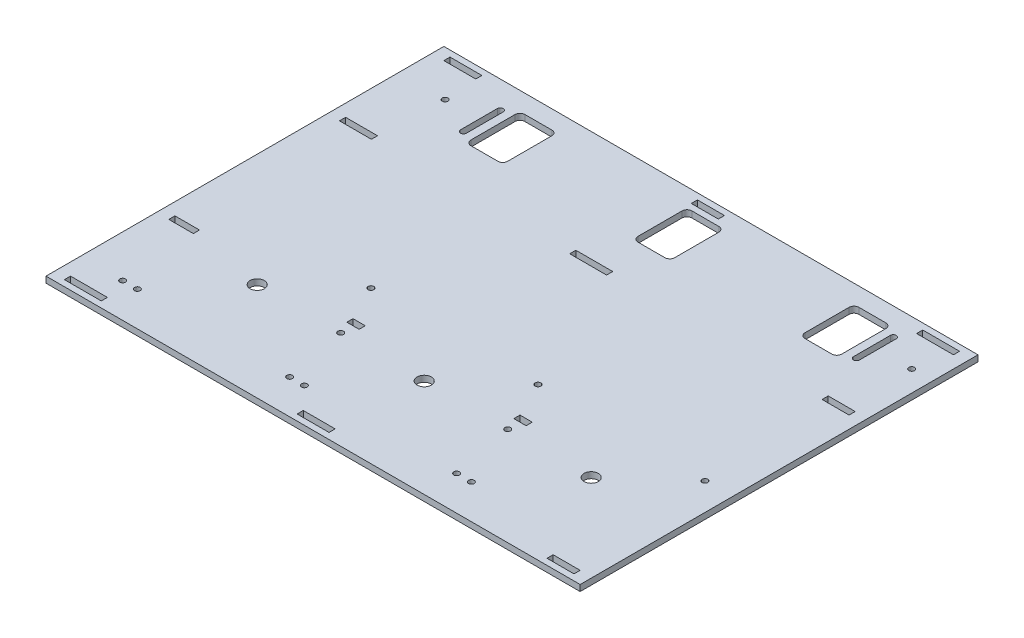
SolidWorks part; units mm, degrees
ref_plane "Front Plane" through (0, 0, 0) normal (0, 0, 1) x (1, 0, 0)
ref_plane "Top Plane" through (0, 0, 0) normal (0, 1, 0) x (1, 0, 0)
ref_plane "Right Plane" through (0, 0, 0) normal (1, 0, 0) x (0, 0, -1)
sketch "Sketch1" plane through (0, 0, 0) normal (0, 1, 0) x (1, 0, 0)
  line L0 (269.875, 145.415) -> (255.905, 145.415)
  line L1 (276.225, 205.74) -> (0, 205.74)
  line L2 (276.225, 205.74) -> (276.225, 0)
  line L3 (276.225, 0) -> (0, 0)
  line L4 (0, 205.74) -> (0, 0)
  line L5 (269.875, 199.39) -> (250.825, 199.39)
  line L6 (269.875, 199.39) -> (269.875, 202.565)
  line L7 (269.875, 202.565) -> (250.825, 202.565)
  line L8 (250.825, 199.39) -> (250.825, 202.565)
  line L9 (148.2725, 199.39) -> (134.3025, 199.39)
  line L10 (148.2725, 199.39) -> (148.2725, 202.565)
  line L11 (148.2725, 202.565) -> (134.3025, 202.565)
  line L12 (134.3025, 199.39) -> (134.3025, 202.565)
  line L13 (22.86, 199.39) -> (6.35, 199.39)
  line L14 (22.86, 199.39) -> (22.86, 202.565)
  line L15 (22.86, 202.565) -> (6.35, 202.565)
  line L16 (6.35, 199.39) -> (6.35, 202.565)
  line L17 (269.875, 145.415) -> (269.875, 148.59)
  line L18 (269.875, 148.59) -> (255.905, 148.59)
  line L19 (255.905, 145.415) -> (255.905, 148.59)
  line L20 (144.4625, 145.415) -> (125.4125, 145.415)
  line L21 (144.4625, 145.415) -> (144.4625, 148.59)
  line L22 (144.4625, 148.59) -> (125.4125, 148.59)
  line L23 (125.4125, 145.415) -> (125.4125, 148.59)
  line L24 (22.86, 145.415) -> (6.35, 145.415)
  line L25 (22.86, 145.415) -> (22.86, 148.59)
  line L26 (22.86, 148.59) -> (6.35, 148.59)
  line L27 (6.35, 145.415) -> (6.35, 148.59)
  line L28 (191.135, 57.15) -> (184.785, 57.15)
  line L29 (191.135, 57.15) -> (191.135, 60.325)
  line L30 (191.135, 60.325) -> (184.785, 60.325)
  line L31 (184.785, 57.15) -> (184.785, 60.325)
  line L32 (101.6, 60.325) -> (101.6, 57.15) construction
  line L33 (104.775, 57.15) -> (98.425, 57.15)
  line L34 (104.775, 57.15) -> (104.775, 60.325)
  line L35 (104.775, 60.325) -> (98.425, 60.325)
  line L36 (19.05, 57.15) -> (6.35, 57.15)
  line L37 (19.05, 57.15) -> (19.05, 60.325)
  line L38 (19.05, 60.325) -> (6.35, 60.325)
  line L39 (6.35, 57.15) -> (6.35, 60.325)
  line L40 (269.875, 3.175) -> (255.905, 3.175)
  line L41 (269.875, 3.175) -> (269.875, 6.35)
  line L42 (269.875, 6.35) -> (255.905, 6.35)
  line L43 (255.905, 3.175) -> (255.905, 6.35)
  line L44 (143.1925, 3.175) -> (126.6825, 3.175)
  line L45 (143.1925, 3.175) -> (143.1925, 6.35)
  line L46 (143.1925, 6.35) -> (126.6825, 6.35)
  line L47 (126.6825, 3.175) -> (126.6825, 6.35)
  line L48 (25.4, 3.175) -> (6.35, 3.175)
  line L49 (25.4, 3.175) -> (25.4, 6.35)
  line L50 (25.4, 6.35) -> (6.35, 6.35)
  line L51 (6.35, 3.175) -> (6.35, 6.35)
  line L52 (144.78, 168.275) -> (144.78, 196.215) construction
  line L53 (154.305, 168.275) -> (135.255, 168.275)
  line L54 (154.305, 168.275) -> (154.305, 196.215)
  line L55 (154.305, 196.215) -> (135.255, 196.215)
  line L56 (135.255, 168.275) -> (135.255, 196.215)
  line L57 (231.14, 168.275) -> (231.14, 196.215) construction
  line L58 (221.615, 168.275) -> (240.665, 168.275)
  line L59 (221.615, 168.275) -> (221.615, 196.215)
  line L60 (221.615, 196.215) -> (240.665, 196.215)
  line L61 (240.665, 168.275) -> (240.665, 196.215)
  line L62 (67.945, 168.275) -> (48.895, 168.275)
  line L63 (67.945, 168.275) -> (67.945, 196.215)
  line L64 (67.945, 196.215) -> (48.895, 196.215)
  line L65 (48.895, 168.275) -> (48.895, 196.215)
  line L66 (58.42, 168.275) -> (58.42, 196.215) construction
  line L67 (231.14, 50.8) -> (144.78, 50.8) construction
  line L68 (144.78, 50.8) -> (58.42, 50.8) construction
  line L69 (43.18, 182.245) -> (246.38, 182.245) construction
  line L70 (43.18, 191.77) -> (43.18, 172.72) construction
  line L71 (44.704, 191.77) -> (44.704, 172.72)
  line L72 (41.656, 191.77) -> (41.656, 172.72)
  line L73 (41.656, 172.72) -> (44.704, 172.72) construction
  line L74 (246.38, 191.77) -> (246.38, 172.72) construction
  line L75 (247.904, 191.77) -> (247.904, 172.72)
  line L76 (244.856, 191.77) -> (244.856, 172.72)
  line L77 (138.1125, 0) -> (138.1125, 205.74) construction
  line L78 (98.425, 57.15) -> (98.425, 60.325)
  line L79 (187.96, 60.325) -> (187.96, 57.15) construction
  circle A0 centre (231.14, 50.8) radius 3.683
  circle A1 centre (144.78, 50.8) radius 3.683
  circle A2 centre (58.42, 50.8) radius 3.683
  arc A3 (44.704, 191.77) -> (41.656, 191.77) centre (43.18, 191.77) ccw
  arc A4 (41.656, 172.72) -> (44.704, 172.72) centre (43.18, 172.72) ccw
  arc A5 (247.904, 191.77) -> (244.856, 191.77) centre (246.38, 191.77) ccw
  arc A6 (244.856, 172.72) -> (247.904, 172.72) centre (246.38, 172.72) ccw
  point P64 (144.78, 182.245)
  point P81 (144.78, 182.245)
  point P84 (43.18, 182.245)
  point P92 (246.38, 182.245)
  point P99 (141.2875, 202.565)
  point P100 (134.9375, 148.59)
  point P101 (134.9375, 6.35)
  dimension "D22" = 7.366
  dimension "D23" = 16.51
  dimension "D2" = 205.74
  dimension "D3" = 276.225
  dimension "D4" = 45.085
  dimension "D5" = 3.175
  dimension "D6" = 6.35
  dimension "D7" = 6.35
  dimension "D8" = 86.36
  dimension "D9" = 85.09
  dimension "D10" = 3.175
  dimension "D11" = 15.24
  dimension "D12" = 19.05
  dimension "D13" = 50.8
  dimension "D14" = 6.35
  dimension "D15" = 3.048
  dimension "D16" = 13.97
  dimension "D17" = 50.8
  dimension "D18" = 3.175
  dimension "D19" = 3.175
  dimension "D20" = 19.05
  dimension "D21" = 13.97
  dimension "D24" = 13.97
  dimension "D25" = 6.35
  dimension "D26" = 19.05
  dimension "D27" = 27.94
  dimension "D28" = 9.525
  dimension "D29" = 3.175
  dimension "D30" = 19.05
  dimension "D31" = 3.175
  dimension "D32" = 16.51
  dimension "D33" = 16.51
  dimension "D34" = 3.175
  dimension "D35" = 19.05
  dimension "D36" = 12.7
  dimension "D37" = 86.36
  dimension "D38" = 3.175
  dimension "D39" = 101.6
extrude "Boss-Extrude1" add sketch "Sketch1" along normal blind 3.175
sketch "Sketch4" plane through (0, 3.175, 0) normal (0, 1, 0) x (1, 0, 0)
  circle A0 centre (231.14, 50.8) radius 29.8889 construction
  circle A1 centre (144.78, 50.8) radius 29.8889 construction
  circle A2 centre (58.42, 50.8) radius 29.8889 construction
  text T0 "   3      4      5      6      7      8      9      0      1      2" font "Arial Rounded MT Bold" height in points 26
  text T1 "   3      4      5      6      7      8      9      0      1      2" font "Arial Rounded MT Bold" height in points 26
  text T2 "   3      4      5      6      7      8      9      0      1      2" font "Arial Rounded MT Bold" height in points 26
extrude "Cut-Extrude2" [suppressed] cut sketch "Sketch4" against normal through all
hole_wizard "#4 Clearance Hole1" positions "Sketch6" profile "Sketch5" hole size "#4" standard "ANSI Inch"
sketch "Sketch6" plane through (0, 3.175, 0) normal (0, 1, 0) x (1, 0, 0)
  line L0 (58.42, 50.8) -> (89.3764, 78.6733) construction
  line L2 (58.42, 50.8) -> (21.8008, 17.8279) construction
  line L6 (58.42, 50.8) -> (58.42, 23.6095) construction
  line L8 (175.7364, 78.6733) -> (108.1608, 17.8279) construction
  line L10 (144.78, 54.483) -> (144.78, 47.117) construction
  line L11 (231.14, 54.483) -> (231.14, 47.117) construction
  line L13 (262.0964, 78.6733) -> (194.5208, 17.8279) construction
  line L14 (144.78, 196.215) -> (144.78, 168.275) construction
  line L15 (154.305, 196.215) -> (135.255, 196.215) construction
  line L16 (135.255, 168.275) -> (154.305, 168.275) construction
  line L18 (144.78, 182.245) -> (24.13, 182.245) construction
  line L19 (21.8008, 17.8279) -> (29.4208, 17.8279) construction
  line L21 (108.1608, 17.8279) -> (115.7808, 17.8279) construction
  line L23 (194.5208, 17.8279) -> (202.1408, 17.8279) construction
  line L25 (144.78, 50.8) -> (58.42, 50.8) construction
  line L26 (231.14, 50.8) -> (144.78, 50.8) construction
  circle A0 centre (144.78, 50.8) radius 3.683 construction
  circle A1 centre (231.14, 50.8) radius 3.683 construction
  point P2 (89.3764, 78.6733)
  point P8 (21.8008, 17.8279)
  point P13 (29.4208, 17.8279)
  point P35 (175.7364, 78.6733)
  point P36 (108.1608, 17.8279)
  point P55 (144.78, 50.8)
  point P68 (262.0964, 78.6733)
  point P69 (194.5208, 17.8279)
  point P72 (231.14, 50.8)
  point P93 (24.13, 182.245)
  point P95 (265.43, 182.245)
  point P106 (115.7808, 17.8279)
  point P108 (202.1408, 17.8279)
  point P123 (101.6, 50.8)
  point P128 (187.96, 50.8)
  dimension "D1" = 41.656
  dimension "D2" = 7.62
  dimension "D3" = 48
  dimension "D4" = 120.65
  dimension "D5" = 49.276
sketch "Sketch5" plane through (89.3764, 3.175, -78.6733) normal (1, 0, 0) x (0, 0, 1)
  line L0 (0, 0) -> (0, 3.175)
  line L1 (0, 3.175) -> (1.4732, 3.175)
  line L2 (1.4732, 3.175) -> (1.4732, 0)
  line L5 (1.4732, 0) -> (0, 0)
  line L11 (0, -6.35) -> (0, 107.95) construction
  dimension "Thru Hole Dia." = 2.9464
  dimension "Thru Hole Depth" = 3.175
fillet "Fillet1" radius 2.54 12 edges at (221.615, 1.5875, -168.275) (221.615, 1.5875, -196.215) (240.665, 1.5875, -196.215) (240.665, 1.5875, -168.275) (154.305, 1.5875, -168.275) (154.305, 1.5875, -196.215) (135.255, 1.5875, -196.215) (135.255, 1.5875, -168.275) (48.895, 1.5875, -168.275) (67.945, 1.5875, -168.275) (67.945, 1.5875, -196.215) (48.895, 1.5875, -196.215)
